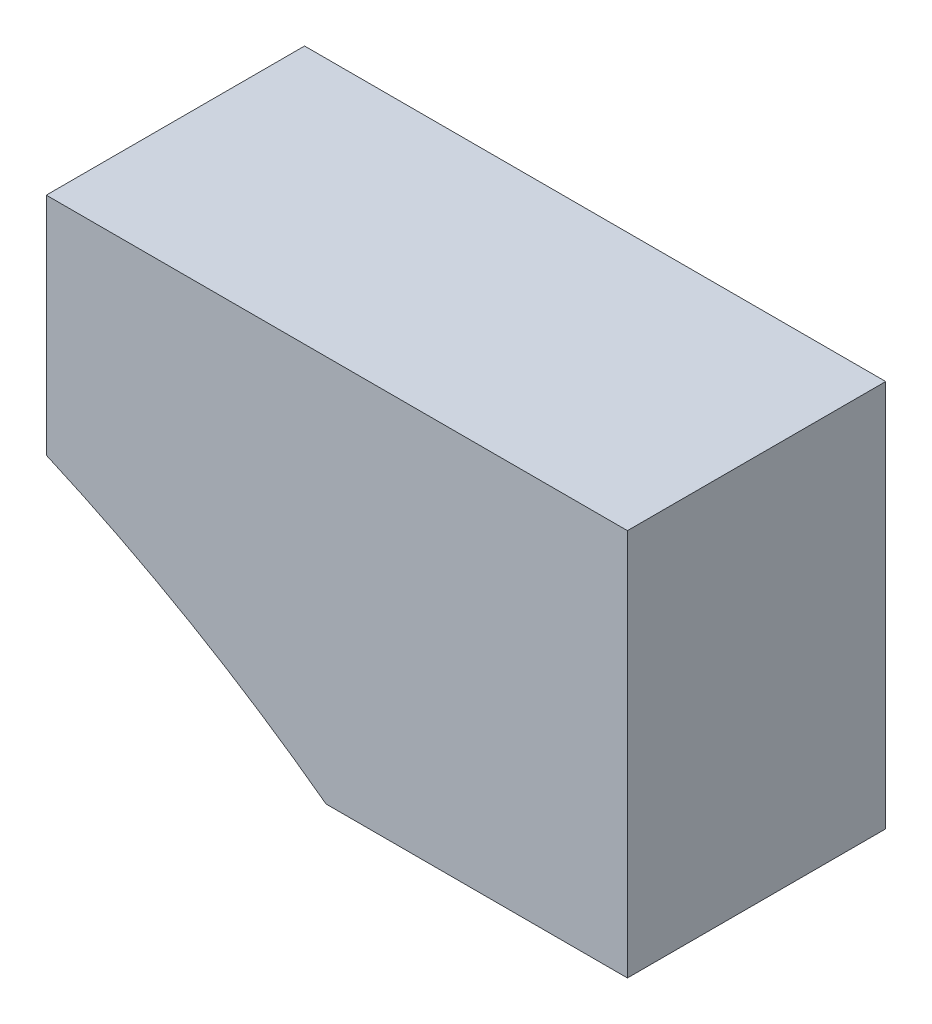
SolidWorks part; units mm, degrees
ref_plane "Plan de face" through (0, 0, 0) normal (0, 0, 1) x (1, 0, 0)
ref_plane "Plan de dessus" through (0, 0, 0) normal (0, 1, 0) x (1, 0, 0)
ref_plane "Plan de droite" through (0, 0, 0) normal (1, 0, 0) x (0, 0, -1)
sketch "Esquisse1" plane through (0, 0, 0) normal (0, 0, 1) x (1, 0, 0)
  line L0 (0, 0) -> (470.6608, 0) construction
  line L1 (0, -55.3377) -> (0, 353.7921) construction
  line L2 (0, 0) -> (442.2765, 160.9755) construction
  line L3 (0, 0) -> (360.5471, 302.5349) construction
  line L4 (0, 0) -> (235.3304, 407.6042) construction
  line L5 (0, 0) -> (81.7294, 463.5104) construction
  line L6 (0, 0) -> (-81.7294, 463.5104) construction
  line L7 (0, 0) -> (-235.3304, 407.6042) construction
  line L8 (0, 0) -> (-360.5471, 302.5349) construction
  line L9 (0, 0) -> (-442.2765, 160.9755) construction
  line L10 (0, 0) -> (-470.6608, 0) construction
  line L11 (-390.3547, -30) -> (366.2536, -30) construction
  line L12 (-390.3547, 30) -> (366.2536, 30) construction
  line L13 (-390.3547, 60) -> (366.2536, 60) construction
  line L14 (22.5, -55.3377) -> (22.5, 160.9755) construction
  line L15 (366.2536, 90) -> (-390.3547, 90) construction
  line L16 (45, -55.3377) -> (45, 160.9755) construction
  line L17 (-390.3547, 120) -> (366.2536, 120) construction
  line L18 (-90, -59.8279) -> (-90, 0) construction
  line L19 (366.2536, 150) -> (-390.3547, 150) construction
  line L20 (67.5, -55.3377) -> (67.5, 160.9755) construction
  line L21 (90, -55.3377) -> (90, 160.9755) construction
  line L22 (112.5, -55.3377) -> (112.5, 160.9755) construction
  line L23 (135, -55.3377) -> (135, 160.9755) construction
  line L24 (157.5, -55.3377) -> (157.5, 160.9755) construction
  line L25 (180, -55.3377) -> (180, 160.9755) construction
  line L26 (202.5, -55.3377) -> (202.5, 160.9755) construction
  line L27 (225, -55.3377) -> (225, 160.9755) construction
  line L28 (66.6633, 90) -> (90, 90)
  line L29 (90, 90) -> (90, 120)
  line L30 (90, 120) -> (45, 120)
  line L31 (45, 120) -> (45, 102.5622)
  arc A0 (90, 0) -> (-90, 0) centre (0, 0) ccw construction
  arc A1 (112, 0) -> (-112, 0) centre (0, 0) ccw construction
  arc A2 (66.6633, 90) -> (45, 102.5622) centre (0, 0) ccw
extrude "Extrusion1" add sketch "Esquisse1" along normal blind 20
